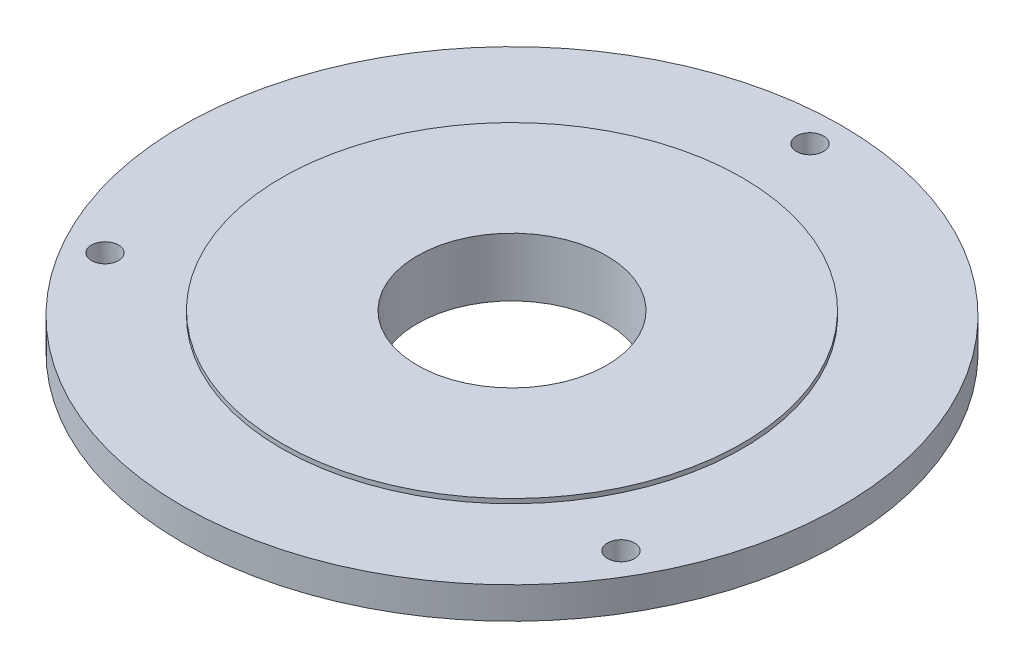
SolidWorks part; units mm, degrees
ref_plane "Piano frontale" through (0, 0, 0) normal (0, 0, 1) x (1, 0, 0)
ref_plane "Piano superiore" through (0, 0, 0) normal (0, 1, 0) x (1, 0, 0)
ref_plane "Piano destro" through (0, 0, 0) normal (1, 0, 0) x (0, 0, -1)
sketch "Schizzo1" plane through (0, 0, 0) normal (0, 0, 1) x (1, 0, 0)
  line L0 (0, 0) -> (0, 68.8521) construction
  line L4 (36.5, 37.8859) -> (36.5, 34.3859)
  line L10 (14.25, 34.3859) -> (36.5, 34.3859)
  line L15 (10.5, 38.3859) -> (25.5, 38.3859)
  line L16 (25.5, 38.3859) -> (25.5, 37.8859)
  line L17 (10.5, 31.8859) -> (10.5, 38.3859)
  line L18 (25.5, 37.8859) -> (36.5, 37.8859)
  line L19 (10.5, 31.8859) -> (14.25, 31.8859)
  line L20 (14.25, 31.8859) -> (14.25, 34.3859)
  dimension "D1" = 25.5
  dimension "D2" = 36.5
  dimension "D3" = 2.5
  dimension "D4" = 0.5
  dimension "D5" = 10.5
  dimension "D6" = 3.5
  dimension "D7" = 14.25
revolve "Rivoluzione1" add sketch "Schizzo1" angle 360 about L0
sketch "Schizzo2" plane through (0, 37.8859, 0) normal (0, 1, 0) x (1, 0, 0)
  circle A0 centre (0, 33) radius 1.5
  circle A1 centre (28.5788, -16.5) radius 1.5
  circle A2 centre (-28.5788, -16.5) radius 1.5
  point P10 (0, 0)
  dimension "D1" = 3
  dimension "D2" = 33
  dimension "D3" = 3
extrude "Taglio-Estrusione1" cut sketch "Schizzo2" against normal through all
